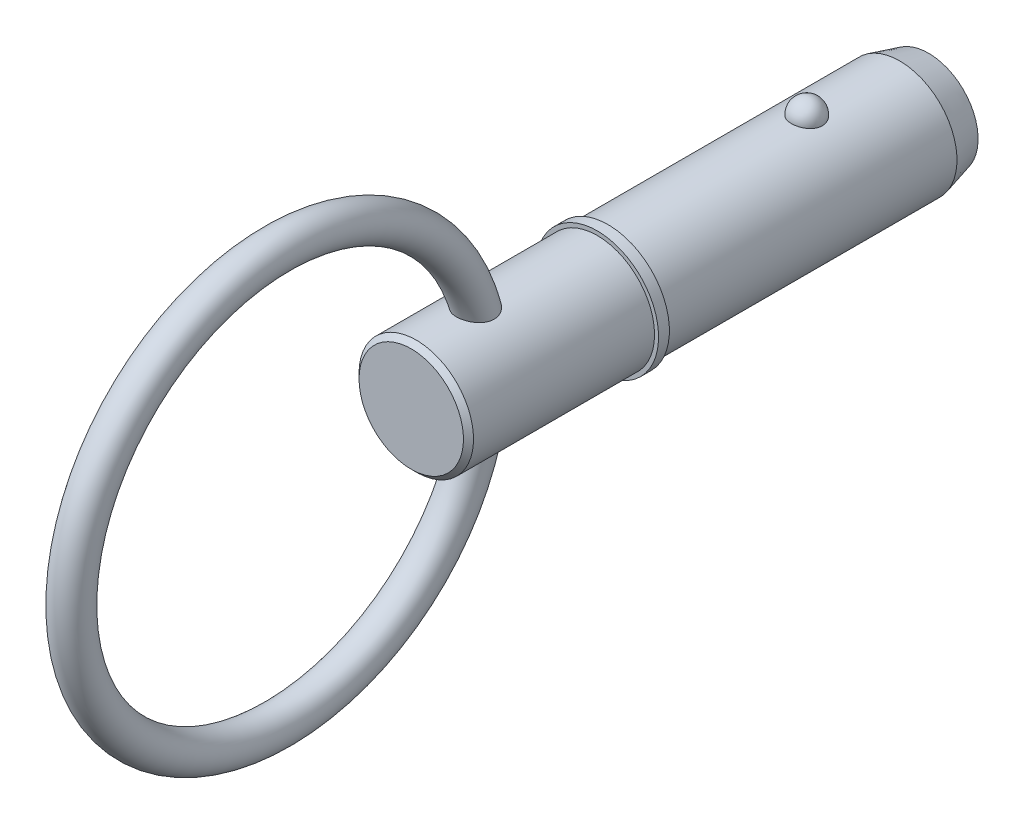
SolidWorks part; units mm, degrees
ref_plane "Front Plane" through (0, 0, 0) normal (0, 0, 1) x (1, 0, 0)
ref_plane "Top Plane" through (0, 0, 0) normal (0, 1, 0) x (1, 0, 0)
ref_plane "Right Plane" through (0, 0, 0) normal (1, 0, 0) x (0, 0, -1)
sketch "Sketch2" plane through (0, 0, 0) normal (0, 0, 1) x (1, 0, 0)
  circle A0 centre (0, 0) radius 7.94
  point P3 (0, 7.94)
  dimension "D1" = 15.88
extrude "Boss-Extrude1" add sketch "Sketch2" along normal blind 25.4
sketch "Sketch3" plane through (0, 0, 0) normal (0, 0, -1) x (-1, 0, 0)
  circle A0 centre (0, 0) radius 7.94
  dimension "D1" = 15.88
extrude "Boss-Extrude2" add sketch "Sketch3" along normal blind 19.05
chamfer "Chamfer1" distance 4 angle 15 1 edges at (-7.94, 0, -19.05)
sketch "Sketch18" plane through (0, 0, 0) normal (1, 0, 0) x (0, 0, -1)
  line L0 (15.05, 7.94) -> (-25.4, 7.94) construction
  line L1 (2.15, 10.09) -> (2.15, 5.79)
  line L2 (-25.4, -7.94) -> (15.05, -7.94) construction
  arc A0 (2.15, 10.09) -> (2.15, 5.79) centre (2.15, 7.94) ccw
  point P4 (0, 7.94)
  dimension "D1" = 18.03
revolve "Revolve1" add sketch "Sketch18" angle 360 about L1
sketch "Sketch19" plane through (0, 0, 0) normal (1, 0, 0) x (0, 0, -1)
  line L0 (-33.7288, 0) -> (-46.4542, 0) construction
sketch "Sketch20" plane through (0, 0, 0) normal (1, 0, 0) x (0, 0, -1)
  line L0 (-25.4, 0) -> (-25.4, 8.5)
  line L1 (-25.4, 7.94) -> (-25.4, -7.94) construction
  line L2 (-25.4, 8.5) -> (-26.9, 8.5)
  line L3 (-26.9, 8.5) -> (-26.9, 0)
  line L4 (-33.7288, 0) -> (-46.4542, 0) construction
  line L5 (-26.9, 0) -> (-25.4, 0)
  dimension "D1" = 8.5
  dimension "D2" = 1.5
revolve "Revolve2" add sketch "Sketch20" angle 360 about L0
sketch "Sketch21" plane through (0, 0, 25.4) normal (0, 0, -1) x (-1, 0, 0)
  circle A0 centre (0, 0) radius 7.94
  dimension "D1" = 15.88
extrude "Boss-Extrude3" add sketch "Sketch21" against normal blind 27.31
chamfer "Chamfer2" distance 0.7 angle 45 1 edges at (-7.94, 0, 52.71)
sketch "Sketch23" plane through (0, 0, 0) normal (1, 0, 0) x (0, 0, -1)
  line L0 (-52.71, 7.24) -> (-52.71, -7.24) construction
  circle A0 centre (-71.285, 0) radius 28.575
  point P2 (-42.71, 0)
  dimension "D1" = 57.15
  dimension "D2" = 10
sketch "Sketch24" plane through (0, 0, 0) normal (0, 1, 0) x (1, 0, 0)
  circle A0 centre (0, -42.71) radius 2.5
  dimension "D1" = 5
sweep "Sweep1" add profiles "Sketch24" path "Sketch23"
